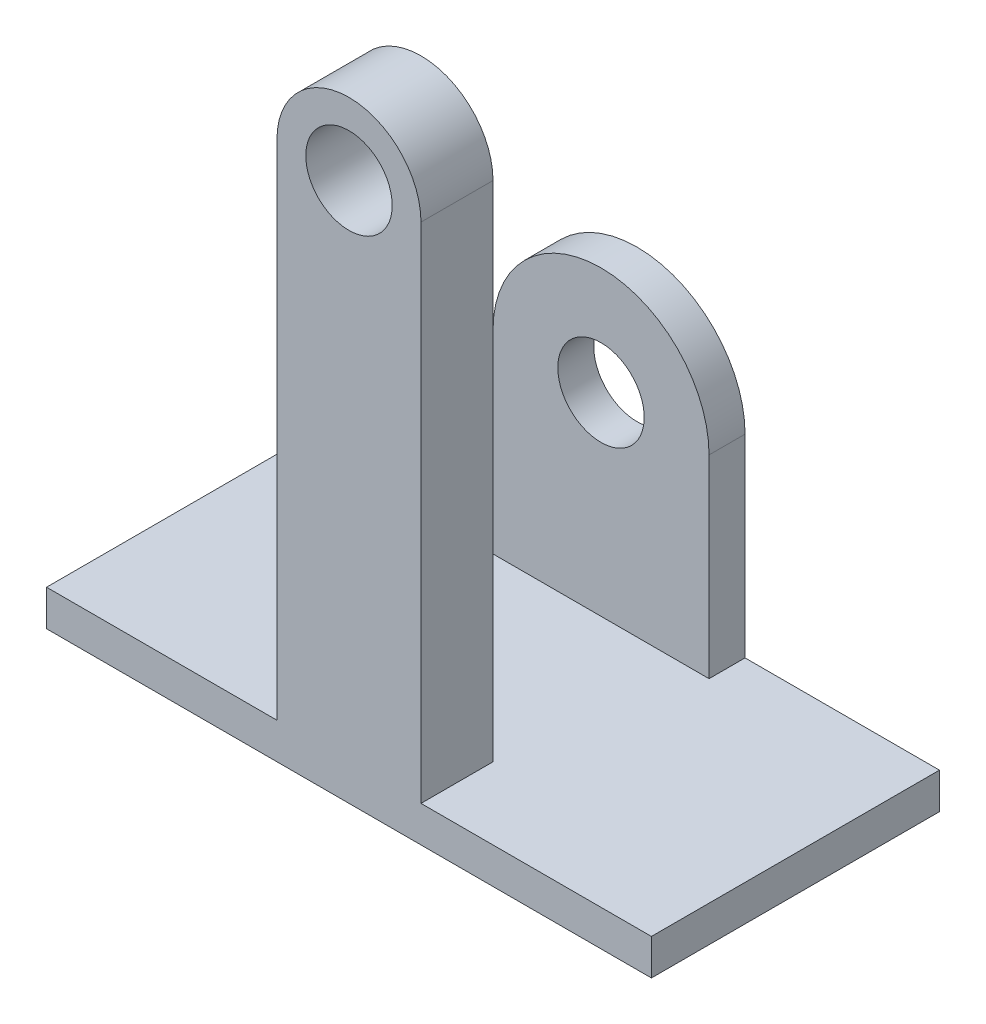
SolidWorks part; units mm, degrees
ref_plane "Face" through (0, 0, 0) normal (0, 0, 1) x (1, 0, 0)
ref_plane "Dessus" through (0, 0, 0) normal (0, 1, 0) x (1, 0, 0)
ref_plane "Droite" through (0, 0, 0) normal (1, 0, 0) x (0, 0, -1)
sketch "Esquisse1" plane through (0, 0, 0) normal (0, 0, 1) x (1, 0, 0)
  circle A0 centre (0, 0) radius 6
  circle A1 centre (0, 0) radius 10
extrude "Extrusion1" add sketch "Esquisse1" along normal blind 10
sketch "Esquisse2" plane through (0, 0, 10) normal (0, 0, 1) x (1, 0, 0)
  line L0 (-10, 0) -> (-10, -70)
  line L1 (10, 0) -> (10, -70)
  line L2 (10, -70) -> (-10, -70)
  circle A0 centre (0, 0) radius 10 construction
  arc A1 (-10, 0) -> (10, 0) centre (0, 0) ccw
  dimension "D1" = 70
extrude "Extrusion2" add sketch "Esquisse2" against normal blind 10
sketch "Esquisse3" plane through (0, 0, 10) normal (0, 0, 1) x (1, 0, 0)
  line L0 (0, 0) -> (0, -62.1981) construction
  line L1 (-42, -74.9116) -> (42, -74.9116)
  line L2 (-42, -74.9116) -> (-42, -69.9116)
  line L3 (-42, -69.9116) -> (42, -69.9116)
  line L4 (42, -74.9116) -> (42, -69.9116)
  dimension "D1" = 42
  dimension "D2" = 42
  dimension "D3" = 5
extrude "Extrusion3" add sketch "Esquisse3" against normal blind 40
sketch "Esquisse4" plane through (0, 0, -30) normal (0, 0, -1) x (-1, 0, 0)
  line L0 (-15.0037, -43) -> (-15.0037, -74.9116)
  line L1 (0, 0) -> (0, -52.8201) construction
  line L2 (42, -74.9116) -> (-42, -74.9116) construction
  line L3 (14.9963, -43) -> (14.9963, -74.9116)
  line L4 (14.9963, -74.9116) -> (-15.0037, -74.9116)
  line L5 (0, -43) -> (23.2054, -43) construction
  line L6 (-42, -69.9116) -> (42, -69.9116) construction
  circle A0 centre (0, -43) radius 6
  circle A1 centre (0, 0) radius 6 construction
  arc A2 (14.9963, -43) -> (-15.0037, -43) centre (-0.0037, -43) ccw
  dimension "D1" = 43
extrude "Extrusion4" add sketch "Esquisse4" against normal up to surface (5 mm away)
